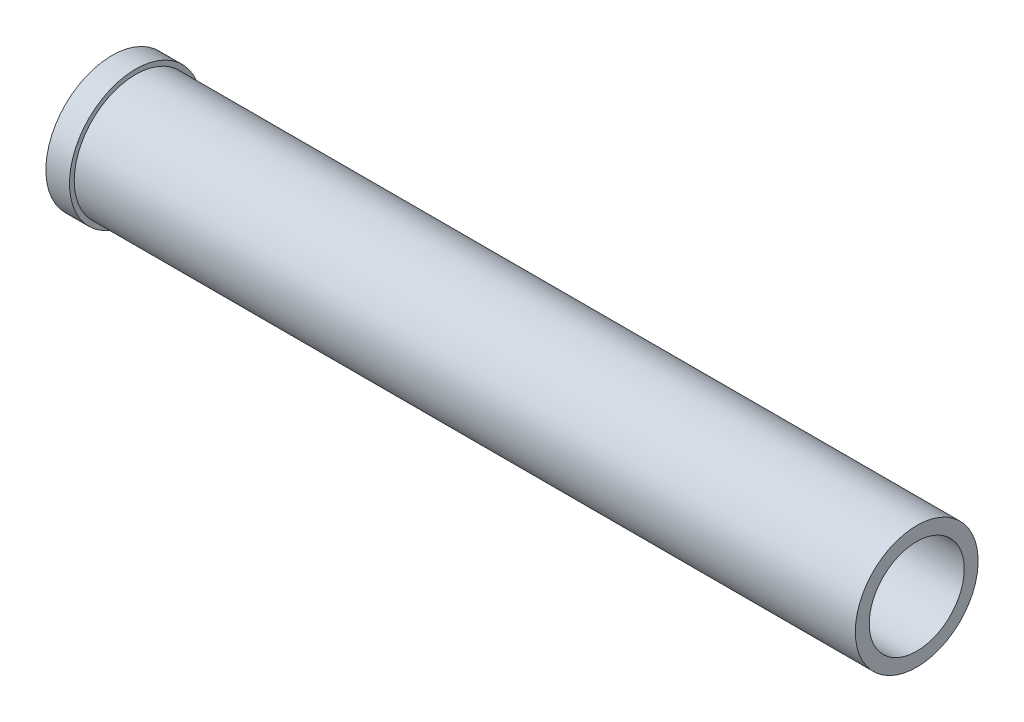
SolidWorks part; units mm, degrees
ref_plane "Face" through (0, 0, 0) normal (0, 0, 1) x (1, 0, 0)
ref_plane "Dessus" through (0, 0, 0) normal (0, 1, 0) x (1, 0, 0)
ref_plane "Droite" through (0, 0, 0) normal (1, 0, 0) x (0, 0, -1)
sketch "Esquisse1" plane through (0, 0, 0) normal (1, 0, 0) x (0, 0, -1)
  circle A0 centre (0, 0) radius 70
  dimension "D1" = 140
extrude "Extrusion1" add sketch "Esquisse1" along normal blind 25
sketch "Esquisse2" plane through (0, 0, 0) normal (-1, 0, 0) x (0, 0, 1)
  circle A0 centre (0, 0) radius 65
  dimension "D1" = 130
extrude "Extrusion2" add sketch "Esquisse2" against normal blind 852
sketch "Esquisse3" plane through (0, 0, 0) normal (-1, 0, 0) x (0, 0, 1)
  circle A0 centre (0, 0) radius 64
  dimension "D1" = 128
extrude "Enlèv. mat.-Extru.1" cut sketch "Esquisse3" against normal blind 730
sketch "Esquisse4" plane through (852, 0, 0) normal (1, 0, 0) x (0, 0, -1)
  circle A0 centre (0, 0) radius 50.3
  dimension "D1" = 100.6
extrude "Enlèv. mat.-Extru.2" cut sketch "Esquisse4" against normal through all
